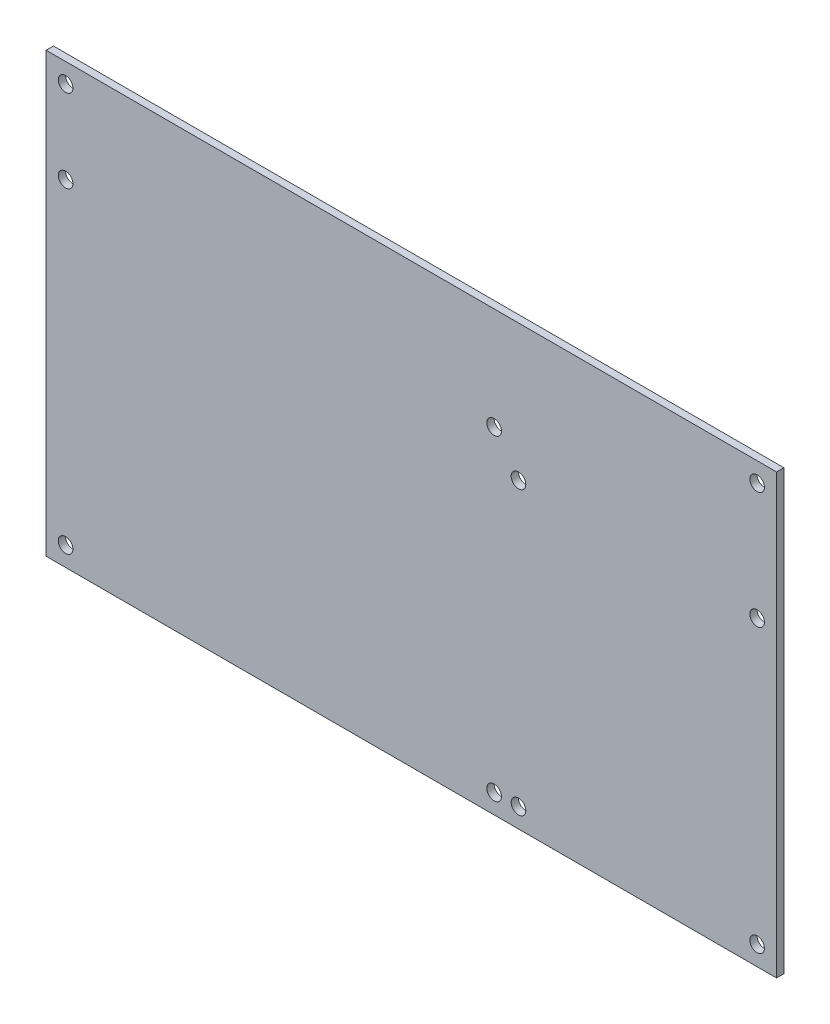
SolidWorks part; units mm, degrees
ref_plane "Ebene vorne" through (0, 0, 0) normal (0, 0, 1) x (1, 0, 0)
ref_plane "Ebene oben" through (0, 0, 0) normal (0, 1, 0) x (1, 0, 0)
ref_plane "Ebene rechts" through (0, 0, 0) normal (1, 0, 0) x (0, 0, -1)
sketch "Skizze2" plane through (0, 0, 0) normal (0, 0, 1) x (1, 0, 0)
  line L0 (75, 0) -> (75, -90) construction
  line L1 (0, 0) -> (150, 0)
  line L2 (0, 0) -> (0, -90)
  line L3 (0, -90) -> (150, -90)
  line L4 (150, 0) -> (150, -90)
  circle A0 centre (146, -4) radius 1.5
  circle A1 centre (146, -86) radius 1.5
  circle A2 centre (4, -86) radius 1.5
  circle A3 centre (4, -4) radius 1.5
  circle A5 centre (4, -21) radius 1.5
  circle A6 centre (92, -86) radius 1.5
  circle A7 centre (92, -21) radius 1.5
  circle A8 centre (97, -86) radius 1.5
  circle A9 centre (97, -28) radius 1.5
  circle A10 centre (146, -28) radius 1.5
  dimension "D3" = 3
  dimension "D4" = 3
  dimension "D5" = 4
  dimension "D6" = 4
  dimension "D7" = 4
  dimension "D8" = 4
  dimension "D11" = 3
  dimension "D12" = 3
  dimension "D13" = 65
  dimension "D14" = 88
  dimension "D15" = 49
  dimension "D16" = 3
  dimension "D17" = 58
  dimension "D18" = 3
  dimension "D19" = 4
  dimension "D20" = 3
  dimension "D1" = 150
  dimension "D2" = 90
  dimension "D9" = 65
  dimension "D10" = 88
extrude "Aufsatz-Linear austragen2" add sketch "Skizze2" along normal blind 1.5
